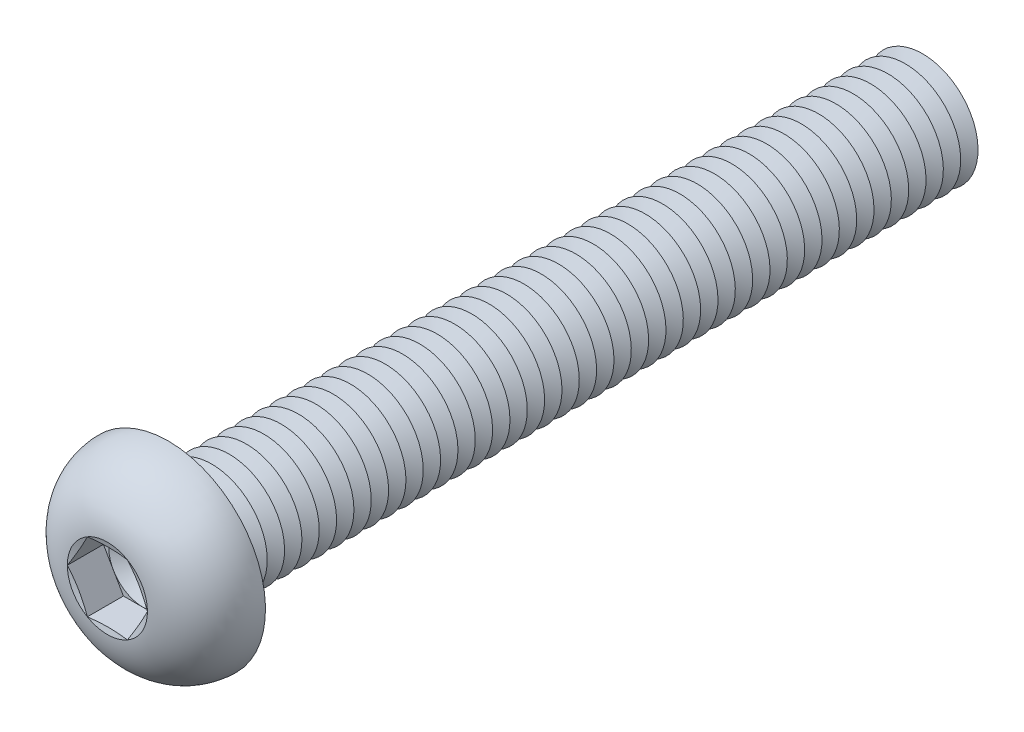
SolidWorks part; units mm, degrees
ref_plane "Front Plane" through (0, 0, 0) normal (0, 0, 1) x (1, 0, 0)
ref_plane "Top Plane" through (0, 0, 0) normal (0, 1, 0) x (1, 0, 0)
ref_plane "Right Plane" through (0, 0, 0) normal (1, 0, 0) x (0, 0, -1)
sketch "Sketch1" plane through (0, 0, 0) normal (1, 0, 0) x (0, 0, -1)
  line L0 (0, 4) -> (0, 7)
  line L3 (0, 4) -> (55, 4)
  line L4 (55, 4) -> (55, 0)
  line L5 (55, 0) -> (-4.4, 0) construction
  line L6 (-4.4, 0) -> (55, 0)
  line L7 (-4.4, 2.8867) -> (-4.4, 1.4434) construction
  line L8 (-4.4, 1.4434) -> (-4.4, 0)
  line L9 (-4.4, 2.8867) -> (-4.0132, 1.4434)
  line L10 (-4.0132, 1.4434) -> (-4.4, 1.4434)
  line L11 (55, 0) -> (22.7481, 0) construction
  line L12 (0, 7) -> (-4.4, 7) construction
  arc A1 (0, 7) -> (-4.4, 2.8867) centre (0, 2.59) ccw
  point P8 (55, 2)
  dimension "D1" = 14
  dimension "D2" = 8
  dimension "D3" = 4.4
  dimension "D4" = 5.7735
  dimension "D5" = 55
  dimension "D6" = 15
revolve "Revolve1" add sketch "Sketch1" angle 360 about L5
fillet "Fillet1" radius 0.625 1 edges at (0, 4, 0)
sketch "Sketch2" plane through (0, 0, 0) normal (1, 0, 0) x (0, 0, -1)
  line L0 (54.375, 4) -> (55.625, 4)
  line L1 (55, 4) -> (0.625, 4) construction
  line L2 (55.625, 4) -> (55, 2.9175)
  line L3 (55, -4) -> (55, 4) construction
  line L4 (55, 2.9175) -> (54.375, 4)
  dimension "D1" = 1.25
revolve "Cut-Revolve1" cut sketch "Sketch2" angle 360 about axis through (0, 0, -55) along (0, 0, -1)
pattern_linear "LPattern1" count 44 spacing 1.25 along (0, 0, 1) of "Cut-Revolve1"
sketch "Sketch3" plane through (0, 0, 4.4) normal (0, 0, 1) x (1, 0, 0)
  line L7 (1.4434, 2.5) -> (-1.4434, 2.5)
  line L8 (-1.4434, 2.5) -> (-2.8867, 0)
  line L9 (-2.8867, 0) -> (-1.4434, -2.5)
  line L10 (-1.4434, -2.5) -> (1.4434, -2.5)
  line L11 (1.4434, -2.5) -> (2.8867, 0)
  line L12 (2.8867, 0) -> (1.4434, 2.5)
  circle A0 centre (0, 0) radius 2.5 construction
  circle A3 centre (0, 0) radius 2.8867 construction
extrude "Cut-Extrude1" cut sketch "Sketch3" against normal blind 2.6
sketch "Sketch4" plane through (0, 0, 1.8) normal (0, 0, 1) x (1, 0, 0)
  line L1 (1.4434, 2.5) -> (-1.4434, 2.5) construction
  circle A0 centre (0, 0) radius 2.5
extrude "Cut-Extrude2" cut sketch "Sketch4" against normal through all draft 60
